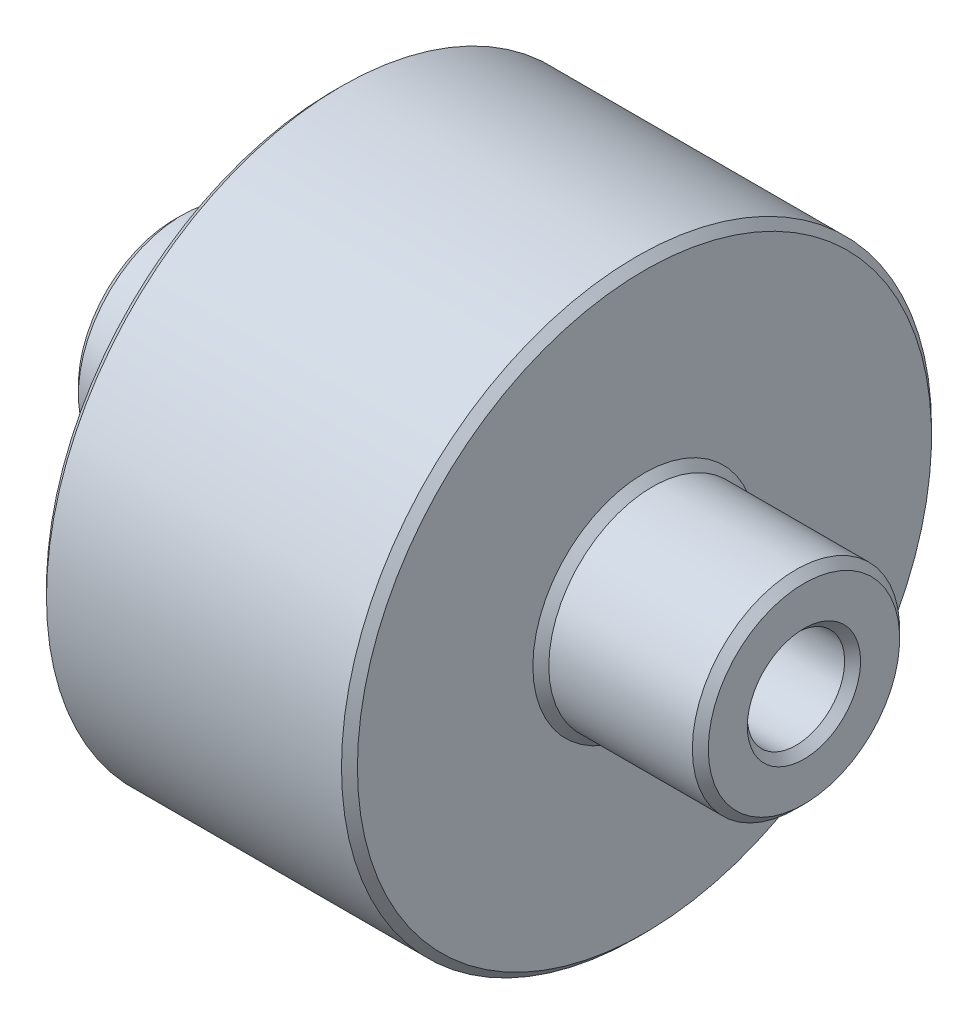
SolidWorks part; units mm, degrees
ref_plane "Спереди" through (0, 0, 0) normal (0, 0, 1) x (1, 0, 0)
ref_plane "Сверху" through (0, 0, 0) normal (0, 1, 0) x (1, 0, 0)
ref_plane "Справа" through (0, 0, 0) normal (1, 0, 0) x (0, 0, -1)
sketch "Эскиз1" plane through (0, 0, 0) normal (0, 0, 1) x (1, 0, 0)
  line L0 (0, 0) -> (53.5572, 0) construction
  line L1 (0, 3.05) -> (39.5, 3.05)
  line L2 (39.5, 3.05) -> (39.5, 6.5)
  line L3 (39.5, 6.5) -> (29.5, 6.5)
  line L4 (29.5, 6.5) -> (29.5, 18.5)
  line L5 (29.5, 18.5) -> (10, 18.5)
  line L6 (10, 18.5) -> (10, 6.5)
  line L7 (10, 6.5) -> (0, 6.5)
  line L8 (0, 6.5) -> (0, 3.05)
  dimension "D1" = 6.1
  dimension "D2" = 13
  dimension "D3" = 10
  dimension "D4" = 19.5
  dimension "D5" = 37
revolve "Повернуть1" add sketch "Эскиз1" angle 360 about L0
chamfer "Фаска1" distance 0.5 angle 45 8 edges at (29.5, 0, 18.5) (10, 0, 18.5) (10, 0, 6.5) (0, 0, 6.5) (39.5, 0, 6.5) (29.5, 0, 6.5) (0, 0, 3.05) (39.5, 0, 3.05)
